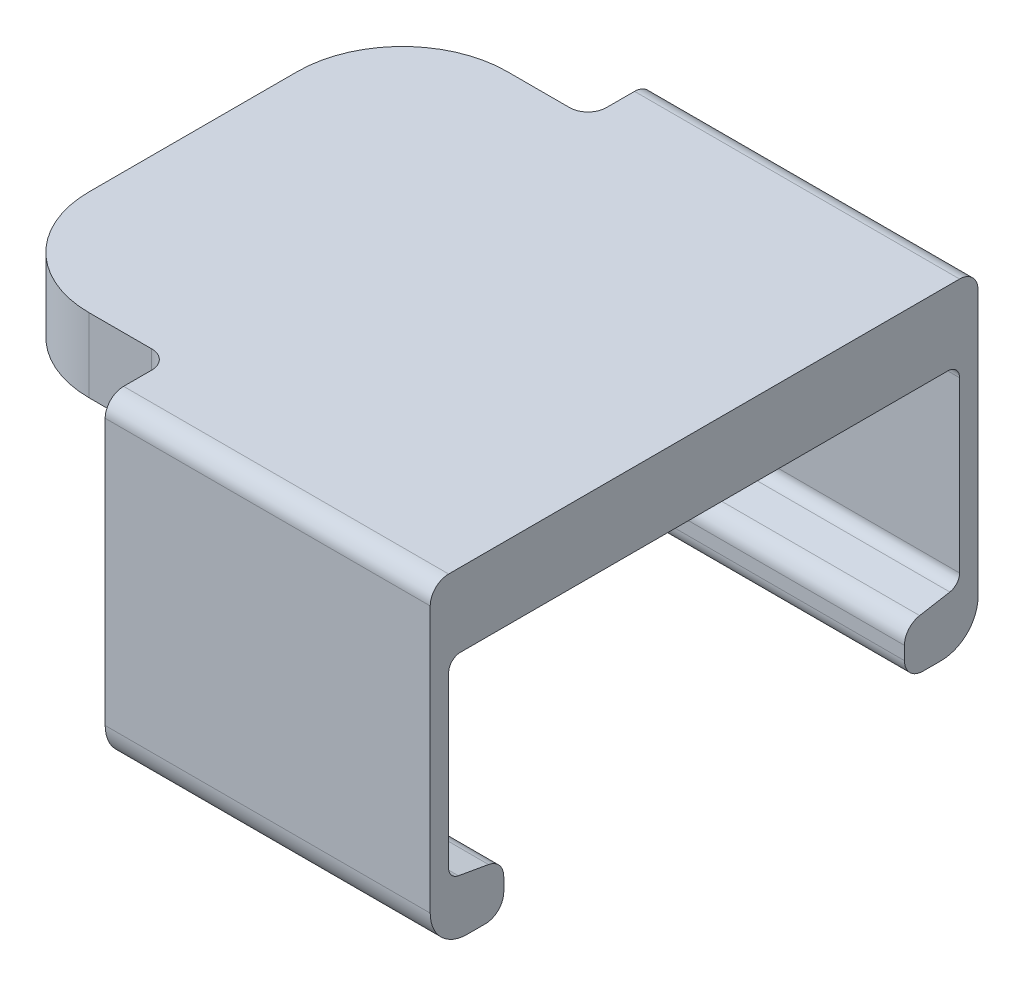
SolidWorks part; units mm, degrees
ref_plane "Front Plane" through (0, 0, 0) normal (0, 0, 1) x (1, 0, 0)
ref_plane "Top Plane" through (0, 0, 0) normal (0, 1, 0) x (1, 0, 0)
ref_plane "Right Plane" through (0, 0, 0) normal (1, 0, 0) x (0, 0, -1)
sketch "Sketch1" plane through (0, 0, 0) normal (1, 0, 0) x (0, 0, -1)
  line L1 (-23.5955, -10.3253) -> (-17.258, -10.3253)
  line L2 (-17.258, -6.2638) -> (-17.258, -10.3253)
  line L3 (0, 17.358) -> (0, 11.008) construction
  line L4 (-12.508, -7.1014) -> (-22.008, -5.4263) construction
  line L5 (0, 11.008) -> (22.008, 11.008)
  line L6 (22.008, -5.4263) -> (22.008, 11.008)
  line L7 (17.258, -6.2638) -> (22.008, -5.4263)
  line L8 (17.258, -6.2638) -> (17.258, -10.3253)
  line L9 (23.5955, -10.3253) -> (17.258, -10.3253)
  line L10 (23.5955, 17.358) -> (23.5955, -10.3253)
  line L11 (0, 17.358) -> (23.5955, 17.358)
  line L12 (-23.5955, 17.358) -> (-23.5955, -10.3253)
  line L14 (0, 17.358) -> (-28.358, 17.358) construction
  line L16 (0, 11.008) -> (-22.008, 11.008)
  line L20 (-17.258, -6.2638) -> (-22.008, -5.4263)
  line L21 (-22.008, -1.992) -> (-22.008, 10.008)
  line L22 (-22.008, -5.4263) -> (-22.008, 11.008)
  line L23 (-19.5, 11.008) -> (19.5, 11.008) construction
  line L24 (0, 17.358) -> (-23.5955, 17.358)
  line L27 (-13.6107, -13.3549) -> (-28.358, -10.7545) construction
  line L28 (-28.358, -10.7545) -> (-28.358, 17.358) construction
  dimension "D1" = 17.258
  dimension "D4" = 10.3253
  dimension "D5" = 100
  dimension "D6" = 4.0615
  dimension "D7" = 1.5875
  dimension "D8" = 1.5875
  dimension "D9" = 10.3253
  dimension "D2" = 0.508
  dimension "D3" = 6.35
extrude "Boss-Extrude1" add sketch "Sketch1" along normal up to vertex (14 mm away) and the other way up to vertex (14 mm away)
sketch "Sketch2" plane through (-14, 0, 0) normal (-1, 0, 0) x (0, 0, 1)
  line L0 (-23.5955, 17.358) -> (23.5955, 17.358) construction
  line L1 (-18, 17.358) -> (18, 17.358)
  line L2 (-18, 17.358) -> (-18, 11.008)
  line L3 (-18, 11.008) -> (18, 11.008)
  line L4 (18, 17.358) -> (18, 11.008)
  line L5 (-18, 17.358) -> (18, 11.008) construction
  line L6 (-18, 11.008) -> (18, 17.358) construction
  line L7 (22.008, 11.008) -> (-22.008, 11.008) construction
  point P4 (0, 14.183)
  dimension "D1" = 18
extrude "Boss-Extrude2" add sketch "Sketch2" along normal blind 16
fillet "Fillet1" radius 9.0297 2 edges at (-30, 14.183, -18) (-30, 14.183, 18)
fillet "Fillet2" radius 3.175 2 edges at (0, -10.3253, -23.5955) (0, -10.3253, 23.5955)
fillet "Fillet3" radius 1.016 4 edges at (0, -5.4263, 22.008) (0, -5.4263, -22.008) (0, 11.008, 22.008) (0, 11.008, -22.008)
fillet "Fillet4" radius 1.5875 8 edges at (0, -10.3253, -17.258) (0, -10.3253, 17.258) (0, -6.2638, 17.258) (0, -6.2638, -17.258) (-14, 14.183, 18) (-14, 14.183, -18) (0, 17.358, -23.5955) (0, 17.358, 23.5955)
sketch "Sketch3" plane through (0, 11.008, 0) normal (0, -1, 0) x (-1, 0, 0)
  line L0 (30, 8.9703) -> (30, -8.9703) construction
  line L1 (20.9703, -18) -> (15.5875, -18) construction
  circle A0 centre (20.1575, -8.1575) radius 9.0297
  point P7 (20.9652, -18)
  dimension "D1" = 9.8425
  dimension "D2" = 9.8425
extrude "Cut-Extrude1" cut sketch "Sketch3" against normal blind 3.048
